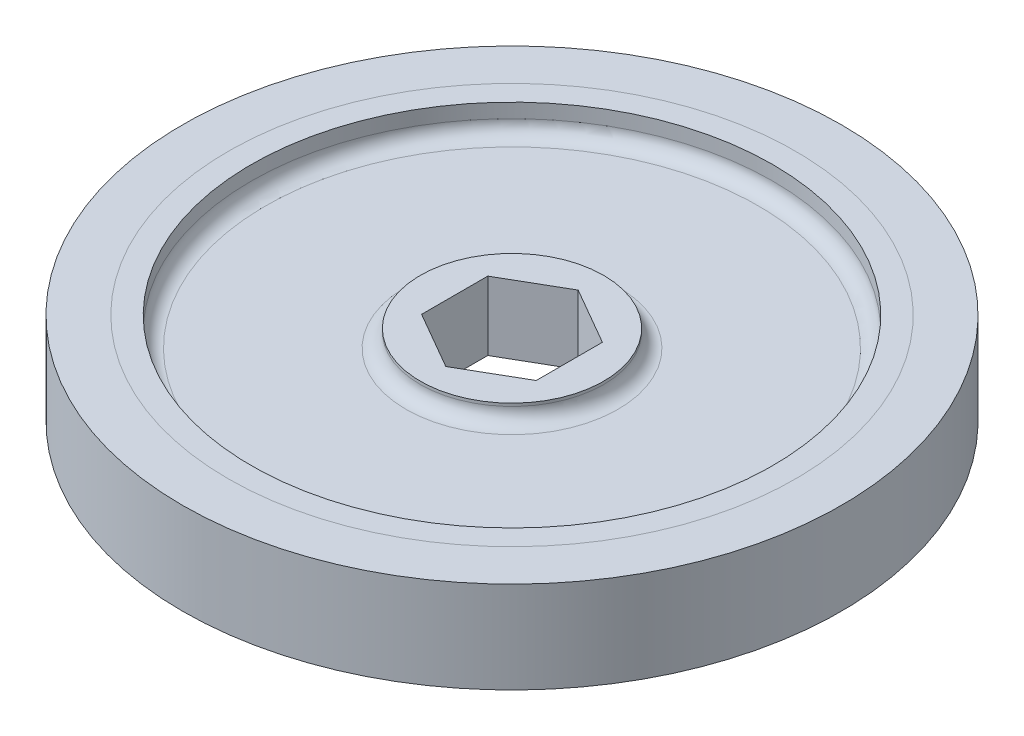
SolidWorks part; units mm, degrees
ref_plane "Front Plane" through (0, 0, 0) normal (0, 0, 1) x (1, 0, 0)
ref_plane "Top Plane" through (0, 0, 0) normal (0, 1, 0) x (1, 0, 0)
ref_plane "Right Plane" through (0, 0, 0) normal (1, 0, 0) x (0, 0, -1)
sketch "Sketch1" plane through (0, 0, 0) normal (0, 0, 1) x (1, 0, 0)
  line L0 (0, 0) -> (10.16, 0)
  line L1 (10.16, 0) -> (10.16, -1.905)
  line L2 (10.16, -1.905) -> (28.8925, -1.905)
  line L3 (28.8925, -1.905) -> (28.8925, 1.27)
  line L4 (28.8925, 1.27) -> (36.5125, 1.27)
  line L5 (36.5125, 1.27) -> (36.5125, -8.89)
  line L6 (36.5125, -3.81) -> (0, -3.81) construction
  line L7 (0, -7.62) -> (0, 0) construction
  line L8 (28.8925, -8.89) -> (36.5125, -8.89)
  line L9 (28.8925, -5.715) -> (28.8925, -8.89)
  line L10 (10.16, -5.715) -> (28.8925, -5.715)
  line L11 (10.16, -7.62) -> (10.16, -5.715)
  line L12 (0, -7.62) -> (10.16, -7.62)
  line L13 (0, 0) -> (0, -7.62)
  dimension "D1" = 10.16
  dimension "D2" = 28.8925
  dimension "D3" = 36.5125
  dimension "D4" = 3.81
  dimension "D5" = 1.905
  dimension "D6" = 5.08
revolve "Revolve1" add sketch "Sketch1" angle 360 about L7
sketch "Sketch2" plane through (0, 0, 0) normal (0, 1, 0) x (1, 0, 0)
  line L1 (0, 7.3323) -> (-6.35, 3.6662)
  line L2 (-6.35, 3.6662) -> (-6.35, -3.6662)
  line L3 (-6.35, -3.6662) -> (0, -7.3323)
  line L4 (0, -7.3323) -> (6.35, -3.6662)
  line L5 (6.35, -3.6662) -> (6.35, 3.6662)
  line L6 (6.35, 3.6662) -> (0, 7.3323)
  circle A0 centre (0, 0) radius 6.35 construction
  dimension "D1" = 12.7
extrude "Cut-Extrude1" cut sketch "Sketch2" against normal through all
fillet "Fillet1" radius 1.5875 4 edges at (0, -5.715, -28.8925) (0, -5.715, -10.16) (0, -1.905, -28.8925) (0, -1.905, -10.16)
sketch "Sketch3" plane through (0, -8.89, 0) normal (0, -1, 0) x (1, 0, 0)
  circle A0 centre (0, 0) radius 31.4325
  dimension "D1" = 62.865
